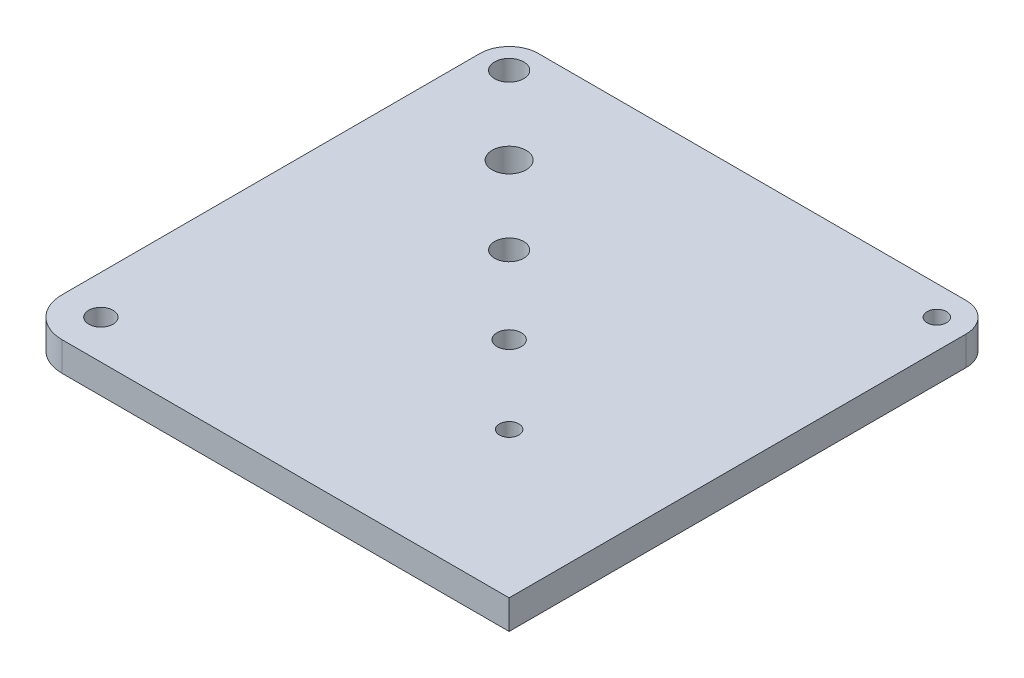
SolidWorks part; units mm, degrees
ref_plane "Front Plane" through (0, 0, 0) normal (0, 0, 1) x (1, 0, 0)
ref_plane "Top Plane" through (0, 0, 0) normal (0, 1, 0) x (1, 0, 0)
ref_plane "Right Plane" through (0, 0, 0) normal (1, 0, 0) x (0, 0, -1)
sketch "Sketch1" plane through (0, 0, 0) normal (0, 1, 0) x (1, 0, 0)
  line L1 (-21, -25) -> (25, -25)
  line L2 (-25, -21) -> (-25, 22)
  line L3 (-22, 25) -> (22, 25)
  line L4 (25, -25) -> (25, 22)
  line L5 (-25, -25) -> (25, 25) construction
  line L6 (-25, 25) -> (25, -25) construction
  arc A0 (-25, 22) -> (-22, 25) centre (-22, 22) cw
  circle A1 centre (-22, 22) radius 1.5
  arc A2 (22, 25) -> (25, 22) centre (22, 22) cw
  circle A3 centre (22, 22) radius 1
  arc A4 (-21, -25) -> (-25, -21) centre (-21, -21) cw
  circle A5 centre (-21, -21) radius 1.25
  circle A6 centre (-14, 14) radius 1.75
  circle A7 centre (-6, 6) radius 1.5
  circle A8 centre (2, -2) radius 1.25
  circle A9 centre (10, -10) radius 1
  point P0 (0, 0)
  dimension "D3" = 3
  dimension "D4" = 3
  dimension "D5" = 3
  dimension "D6" = 2
  dimension "D7" = 4
  dimension "D8" = 2.5
  dimension "D9" = 3.5
  dimension "D10" = 3
  dimension "D11" = 2.5
  dimension "D12" = 2
  dimension "D1" = 50
  dimension "D2" = 50
  dimension "D13" = 8
  dimension "D14" = 8
  dimension "D15" = 8
  dimension "D16" = 8
extrude "Boss-Extrude1" add sketch "Sketch1" along normal blind 3
